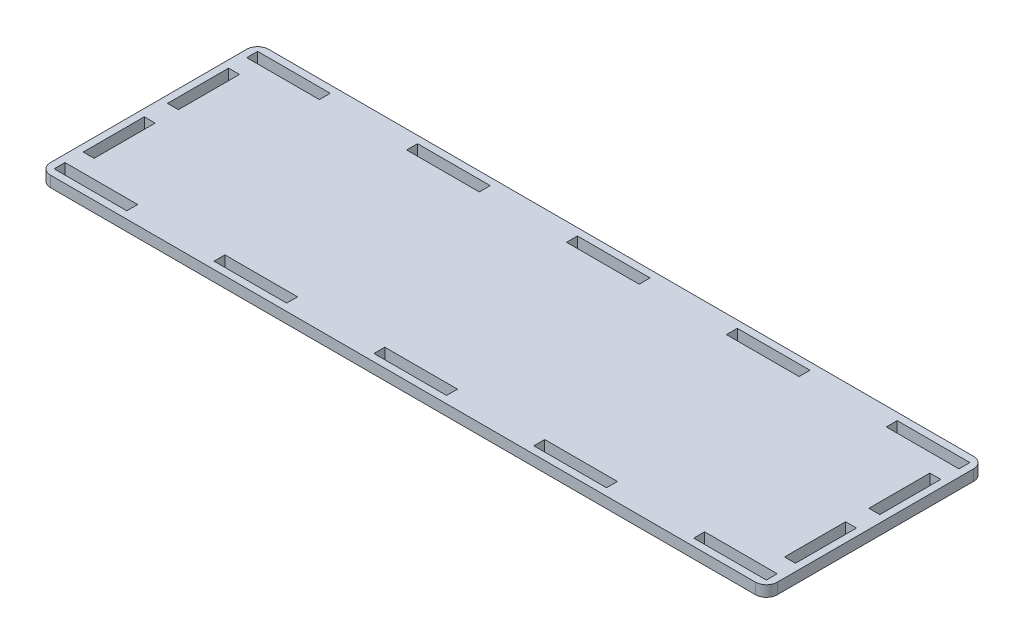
SolidWorks part; units mm, degrees
ref_plane "Front" through (0, 0, 0) normal (0, 0, 1) x (1, 0, 0)
ref_plane "Top" through (0, 0, 0) normal (0, 1, 0) x (1, 0, 0)
ref_plane "Right" through (0, 0, 0) normal (1, 0, 0) x (0, 0, -1)
sketch "Эскиз1" plane through (0, 0, 0) normal (0, 1, 0) x (1, 0, 0)
  line L0 (46, -2) -> (66, -2)
  line L1 (2, -2) -> (22, -2)
  line L2 (2, -2) -> (2, -5)
  line L3 (2, -5) -> (22, -5)
  line L4 (22, -2) -> (22, -5)
  line L5 (3, 0) -> (197, 0)
  line L6 (0, -3) -> (0, -57)
  line L7 (3, -60) -> (197, -60)
  line L8 (200, -3) -> (200, -57)
  line L9 (46, -2) -> (46, -5)
  line L10 (46, -5) -> (66, -5)
  line L11 (66, -2) -> (66, -5)
  line L12 (90, -2) -> (110, -2)
  line L13 (90, -2) -> (90, -5)
  line L14 (90, -5) -> (110, -5)
  line L15 (110, -2) -> (110, -5)
  line L16 (134, -2) -> (154, -2)
  line L17 (134, -2) -> (134, -5)
  line L18 (134, -5) -> (154, -5)
  line L19 (154, -2) -> (154, -5)
  line L20 (178, -2) -> (198, -2)
  line L21 (178, -2) -> (178, -5)
  line L22 (178, -5) -> (198, -5)
  line L23 (198, -2) -> (198, -5)
  line L24 (46, -55) -> (66, -55)
  line L25 (46, -55) -> (46, -58)
  line L26 (46, -58) -> (66, -58)
  line L27 (66, -55) -> (66, -58)
  line L28 (90, -55) -> (110, -55)
  line L29 (90, -55) -> (90, -58)
  line L30 (90, -58) -> (110, -58)
  line L31 (110, -55) -> (110, -58)
  line L32 (134, -55) -> (154, -55)
  line L33 (134, -55) -> (134, -58)
  line L34 (134, -58) -> (154, -58)
  line L35 (154, -55) -> (154, -58)
  line L36 (178, -55) -> (198, -55)
  line L37 (178, -55) -> (178, -58)
  line L38 (178, -58) -> (198, -58)
  line L39 (198, -55) -> (198, -58)
  line L40 (2, -55) -> (22, -55)
  line L41 (2, -55) -> (2, -58)
  line L42 (2, -58) -> (22, -58)
  line L43 (22, -55) -> (22, -58)
  line L44 (2, -10) -> (5, -10)
  line L45 (195, -10) -> (198, -10)
  line L46 (195, -10) -> (195, -26.8023)
  line L47 (195, -26.8023) -> (198, -26.8023)
  line L48 (198, -10) -> (198, -26.8023)
  line L49 (2, -10) -> (2, -26.8023)
  line L50 (2, -26.8023) -> (5, -26.8023)
  line L51 (5, -10) -> (5, -26.8023)
  line L52 (2, -33.1977) -> (5, -33.1977)
  line L53 (2, -33.1977) -> (2, -50)
  line L54 (2, -50) -> (5, -50)
  line L55 (5, -33.1977) -> (5, -50)
  line L56 (195, -33.1977) -> (198, -33.1977)
  line L57 (195, -33.1977) -> (195, -50)
  line L58 (195, -50) -> (198, -50)
  line L59 (198, -33.1977) -> (198, -50)
  arc A0 (197, -60) -> (200, -57) centre (197, -57) ccw
  arc A1 (197, 0) -> (200, -3) centre (197, -3) cw
  arc A2 (0, -57) -> (3, -60) centre (3, -57) ccw
  arc A3 (3, 0) -> (0, -3) centre (3, -3) ccw
  point P48 (2, -18.4011)
  point P49 (198, -56.5)
  point P64 (200, -60)
  point P67 (200, 0)
  point P72 (0, 0)
  dimension "D1" = 3
  dimension "D19" = 3
  dimension "D2" = 2
  dimension "D3" = 200
  dimension "D4" = 60
  dimension "D5" = 2
  dimension "D6" = 20
  dimension "D7" = 2
  dimension "D9" = 2
  dimension "D10" = 10
  dimension "D11" = 3
  dimension "D12" = 2
  dimension "D15" = 10
  dimension "D16" = 2
  dimension "D17" = 2
  dimension "D18" = 2
  dimension "D8" = 5
  dimension "D14" = 2
  dimension "D13" = 2
extrude "Бобышка-Вытянуть1" add sketch "Эскиз1" along normal blind 3
